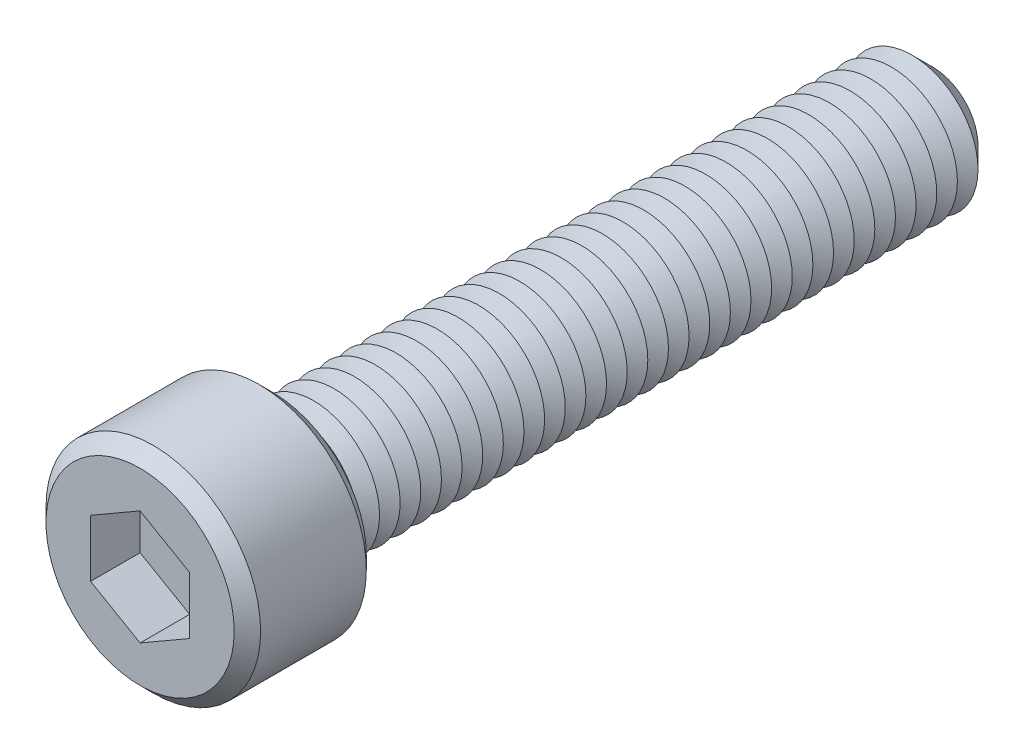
SolidWorks part; units mm, degrees
ref_plane "Front Plane" through (0, 0, 0) normal (0, 0, 1) x (1, 0, 0)
ref_plane "Top Plane" through (0, 0, 0) normal (0, 1, 0) x (1, 0, 0)
ref_plane "Right Plane" through (0, 0, 0) normal (1, 0, 0) x (0, 0, -1)
sketch "Sketch1" plane through (0, 0, 0) normal (0, 0, 1) x (1, 0, 0)
  circle A0 centre (0, 0) radius 6.5
  dimension "D1" = 13
extrude "Boss-Extrude1" add sketch "Sketch1" along normal blind 8
sketch "Sketch2" plane through (0, 0, 0) normal (0, 0, -1) x (-1, 0, 0)
  circle A0 centre (0, 0) radius 4
  dimension "D1" = 8
extrude "Boss-Extrude2" add sketch "Sketch2" along normal blind 40
chamfer "Chamfer1" distance 1.25 angle 45 1 edges at (-4, 0, -40)
sketch "Sketch3" plane through (0, 0, 0) normal (1, 0, 0) x (0, 0, -1)
  line L0 (-2.5121, 0) -> (4.5776, 0) construction
sketch "Sketch4" plane through (0, 0, 0) normal (1, 0, 0) x (0, 0, -1)
  line L0 (0, 4) -> (0.625, 2.9175)
  line L1 (0.625, 2.9175) -> (1.25, 4)
  line L2 (38.75, 4) -> (0, 4) construction
  line L3 (1.25, 4) -> (0, 4)
  dimension "D1" = 1.25
revolve "Cut-Revolve1" cut sketch "Sketch4" angle 360 about L0
pattern_linear "LPattern1" count 31 spacing 1.25 along (0, 0, -1) of "Cut-Revolve1"
sketch "Sketch5" plane through (0, 0, 8) normal (0, 0, 1) x (1, 0, 0)
  line L1 (0, 3.4641) -> (-3, 1.7321)
  line L2 (-3, 1.7321) -> (-3, -1.7321)
  line L3 (-3, -1.7321) -> (0, -3.4641)
  line L4 (0, -3.4641) -> (3, -1.7321)
  line L5 (3, -1.7321) -> (3, 1.7321)
  line L6 (3, 1.7321) -> (0, 3.4641)
  circle A0 centre (0, 0) radius 3 construction
  dimension "D1" = 6
extrude "Cut-Extrude1" cut sketch "Sketch5" against normal blind 3
sketch "Sketch6" plane through (0, 0, 5) normal (0, 0, 1) x (1, 0, 0)
  circle A0 centre (0, 0) radius 0.9
  dimension "D1" = 1.8
extrude "Cut-Extrude2" cut sketch "Sketch6" against normal up to surface (45 mm away)
chamfer "Chamfer2" distance 0.8 angle 45 2 edges at (6.5, 0, 0) (6.5, 0, 8)
